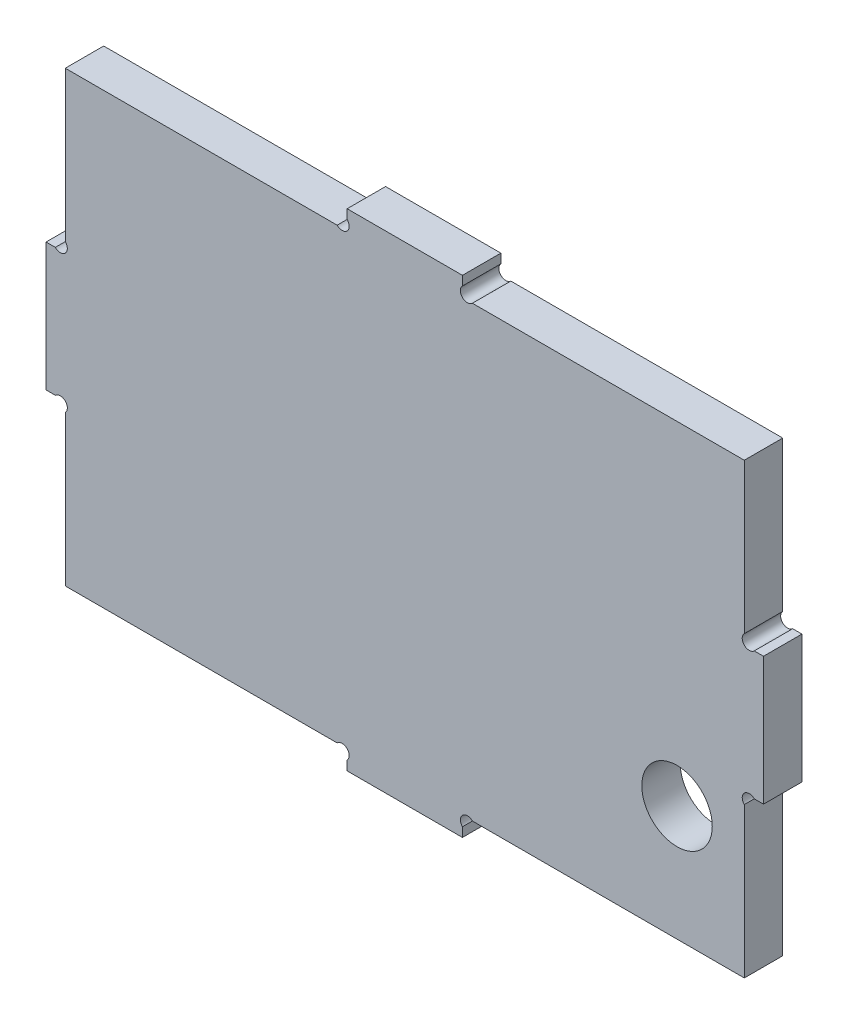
SolidWorks part; units mm, degrees
ref_plane "Plan de face" through (0, 0, 0) normal (0, 0, 1) x (1, 0, 0)
ref_plane "Plan de dessus" through (0, 0, 0) normal (0, 1, 0) x (1, 0, 0)
ref_plane "Plan de droite" through (0, 0, 0) normal (1, 0, 0) x (0, 0, -1)
sketch "Esquisse1" plane through (0, 0, 0) normal (0, 0, 1) x (1, 0, 0)
  line L0 (0, -8.4444) -> (0, 93.9266) construction
  line L1 (-6.6667, 0) -> (150.1448, 0) construction
  line L2 (-6.6667, 70) -> (150.1448, 70) construction
  line L3 (112, -8.4444) -> (112, 93.9266) construction
  line L4 (56, 86.3032) -> (56, 32) construction
  line L5 (84.473, 73) -> (39.6035, 73) construction
  line L6 (65, 86.3032) -> (65, 57.5518) construction
  line L7 (65, 70) -> (77.6534, 82.6534) construction
  line L8 (65, 71.5556) -> (65, 73)
  line L9 (47, 71.5556) -> (47, 73)
  line L10 (47, 73) -> (65, 73)
  line L11 (66.5556, 70) -> (109, 70)
  line L12 (3, 70) -> (45.4444, 70)
  line L13 (54.1834, 35) -> (140.4896, 35) construction
  line L14 (47, -3) -> (65, -3)
  line L15 (47, -1.5556) -> (47, -3)
  line L16 (65, -1.5556) -> (65, -3)
  line L17 (66.5556, 0) -> (109, 0)
  line L18 (45.4444, 0) -> (3, 0)
  line L19 (109, 79.2056) -> (109, -21.034) construction
  line L20 (109, 70) -> (109, 46.5556)
  line L21 (132.4541, 45) -> (100.7719, 45) construction
  line L22 (109, 45) -> (122.6986, 58.6986) construction
  line L23 (110.5556, 45) -> (112, 45)
  line L24 (112, 25) -> (110.5556, 25)
  line L25 (109, 23.4444) -> (109, 0)
  line L26 (112, 45) -> (112, 25)
  line L27 (0, 45) -> (0, 25)
  line L28 (3, 23.4444) -> (3, 0)
  line L29 (0, 25) -> (1.4444, 25)
  line L30 (1.4444, 45) -> (0, 45)
  line L31 (3, 70) -> (3, 46.5556)
  line L32 (140.4896, 18) -> (70.2227, 18) construction
  line L33 (98.5, 26.9931) -> (98.5, -17.673) construction
  arc A0 (65, 71.5556) -> (66.5556, 70) centre (65.7778, 70.7778) ccw
  arc A1 (47, 71.5556) -> (45.4444, 70) centre (46.2222, 70.7778) cw
  arc A2 (47, -1.5556) -> (45.4444, 0) centre (46.2222, -0.7778) ccw
  arc A3 (65, -1.5556) -> (66.5556, 0) centre (65.7778, -0.7778) cw
  arc A4 (109, 46.5556) -> (110.5556, 45) centre (109.7778, 45.7778) ccw
  arc A5 (109, 23.4444) -> (110.5556, 25) centre (109.7778, 24.2222) cw
  arc A6 (3, 23.4444) -> (1.4444, 25) centre (2.2222, 24.2222) ccw
  arc A7 (3, 46.5556) -> (1.4444, 45) centre (2.2222, 45.7778) cw
  circle A8 centre (98.5, 18) radius 5.5
  dimension "D7" = 35
  dimension "D9" = 18
  dimension "D1" = 70
  dimension "D2" = 112
  dimension "D3" = 56
  dimension "D4" = 3
  dimension "D5" = 9
  dimension "D6" = 45
  dimension "D8" = 3
  dimension "D10" = 45
  dimension "D11" = 10
  dimension "D12" = 10.5
extrude "Boss.-Extru.1" add sketch "Esquisse1" along normal blind 6
